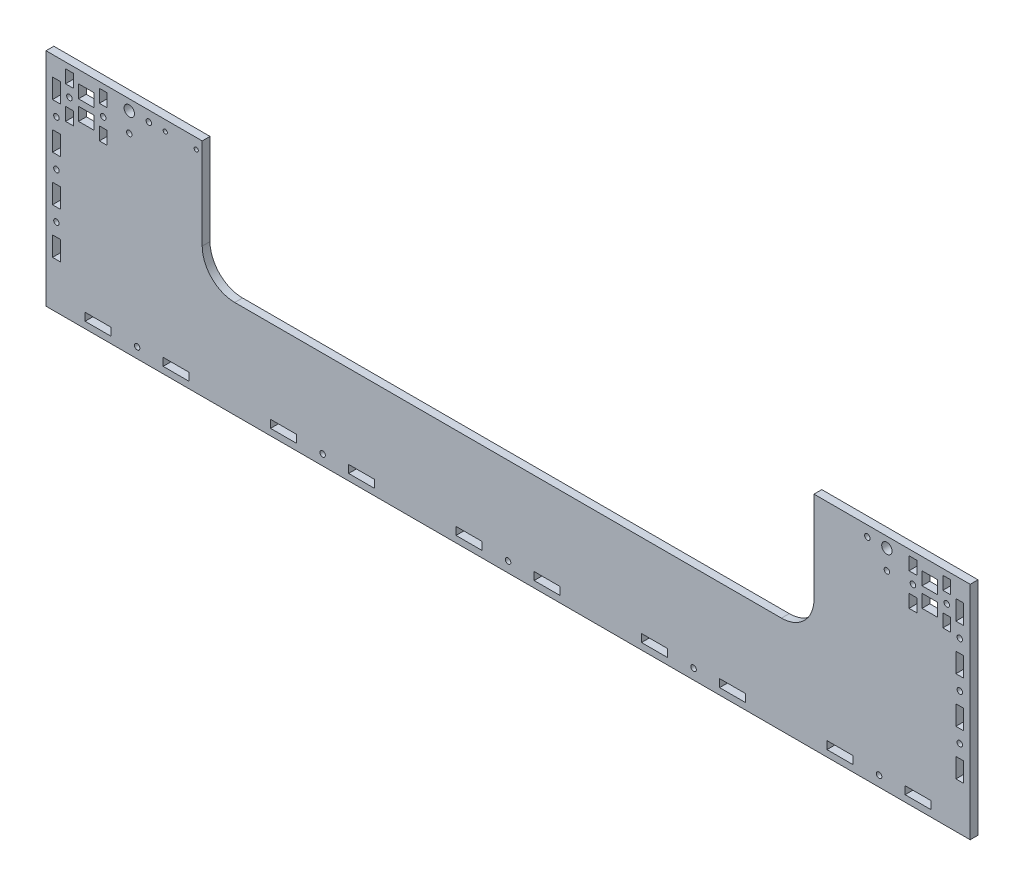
SolidWorks part; units mm, degrees
ref_plane "Спереди" through (0, 0, 0) normal (0, 0, 1) x (1, 0, 0)
ref_plane "Сверху" through (0, 0, 0) normal (0, 1, 0) x (1, 0, 0)
ref_plane "Справа" through (0, 0, 0) normal (1, 0, 0) x (0, 0, -1)
sketch "Эскиз2" plane through (0, 0, 0) normal (0, 0, 1) x (1, 0, 0)
  line L0 (0, 0) -> (0, -67.0909) construction
  line L1 (344, 50) -> (344, 35)
  line L2 (-350, 155) -> (-344, 155)
  line L3 (-350, 155) -> (-350, 140)
  line L4 (-350, 140) -> (-344, 140)
  line L5 (-344, 155) -> (-344, 140)
  line L6 (-350, 120) -> (-344, 120)
  line L7 (-350, 120) -> (-350, 105)
  line L8 (-350, 105) -> (-344, 105)
  line L9 (-344, 120) -> (-344, 105)
  line L10 (-350, 85) -> (-344, 85)
  line L11 (-350, 85) -> (-350, 70)
  line L12 (-350, 70) -> (-344, 70)
  line L13 (-344, 85) -> (-344, 70)
  line L14 (-355, 170) -> (355, 170)
  line L15 (-355, 170) -> (-355, 0)
  line L16 (-355, 0) -> (355, 0)
  line L17 (355, 170) -> (355, 0)
  line L18 (-350, 50) -> (-344, 50)
  line L19 (-350, 50) -> (-350, 35)
  line L20 (-350, 35) -> (-344, 35)
  line L21 (-344, 50) -> (-344, 35)
  line L22 (350, 35) -> (344, 35)
  line L23 (350, 50) -> (350, 35)
  line L24 (350, 50) -> (344, 50)
  line L25 (344, 85) -> (344, 70)
  line L26 (350, 70) -> (344, 70)
  line L27 (350, 85) -> (350, 70)
  line L28 (350, 85) -> (344, 85)
  line L29 (344, 120) -> (344, 105)
  line L30 (350, 105) -> (344, 105)
  line L31 (350, 120) -> (350, 105)
  line L32 (350, 120) -> (344, 120)
  line L33 (344, 155) -> (344, 140)
  line L34 (350, 140) -> (344, 140)
  line L35 (350, 155) -> (350, 140)
  line L36 (350, 155) -> (344, 155)
  circle A0 centre (-347, 130) radius 2.1
  circle A1 centre (-347, 95) radius 2.1
  circle A2 centre (-347, 60) radius 2.1
  circle A3 centre (347, 60) radius 2.1
  circle A4 centre (347, 95) radius 2.1
  circle A5 centre (347, 130) radius 2.1
  point P19 (-347, 140)
  point P20 (-347, 105)
  point P26 (0, 0)
  point P27 (-355, 85)
  point P33 (-347, 70)
  point P34 (-347, 35)
  point P57 (347, 35)
  point P58 (347, 70)
  point P59 (355, 85)
  point P60 (347, 105)
  point P61 (347, 140)
extrude "Бобышка-Вытянуть1" add sketch "Эскиз2" along normal blind 6
sketch "Эскиз3" plane through (0, 0, 6) normal (0, 0, 1) x (1, 0, 0)
  line L0 (-355, 0) -> (355, 0) construction
  line L1 (-325, 11) -> (-305, 11)
  line L2 (-325, 11) -> (-325, 5)
  line L3 (-325, 5) -> (-305, 5)
  line L4 (-305, 11) -> (-305, 5)
  line L5 (-265, 11) -> (-245, 11)
  line L6 (-265, 11) -> (-265, 5)
  line L7 (-265, 5) -> (-245, 5)
  line L8 (-245, 11) -> (-245, 5)
  line L9 (-182.5, 11) -> (-162.5, 11)
  line L10 (-182.5, 11) -> (-182.5, 5)
  line L11 (-182.5, 5) -> (-162.5, 5)
  line L12 (-162.5, 11) -> (-162.5, 5)
  line L13 (-122.5, 11) -> (-102.5, 11)
  line L14 (-122.5, 11) -> (-122.5, 5)
  line L15 (-122.5, 5) -> (-102.5, 5)
  line L16 (-102.5, 11) -> (-102.5, 5)
  line L17 (-40, 11) -> (-20, 11)
  line L18 (-40, 11) -> (-40, 5)
  line L19 (-40, 5) -> (-20, 5)
  line L20 (-20, 11) -> (-20, 5)
  line L21 (0, 0) -> (0, -153.1554) construction
  line L22 (20, 11) -> (20, 5)
  line L23 (40, 5) -> (20, 5)
  line L24 (40, 11) -> (40, 5)
  line L25 (40, 11) -> (20, 11)
  line L26 (102.5, 11) -> (102.5, 5)
  line L27 (122.5, 5) -> (102.5, 5)
  line L28 (122.5, 11) -> (122.5, 5)
  line L29 (122.5, 11) -> (102.5, 11)
  line L30 (162.5, 11) -> (162.5, 5)
  line L31 (182.5, 5) -> (162.5, 5)
  line L32 (182.5, 11) -> (182.5, 5)
  line L33 (182.5, 11) -> (162.5, 11)
  line L34 (245, 11) -> (245, 5)
  line L35 (265, 5) -> (245, 5)
  line L36 (265, 11) -> (265, 5)
  line L37 (265, 11) -> (245, 11)
  line L38 (305, 11) -> (305, 5)
  line L39 (325, 5) -> (305, 5)
  line L40 (325, 11) -> (325, 5)
  line L41 (325, 11) -> (305, 11)
  circle A0 centre (-285, 8) radius 2.1
  circle A1 centre (-142.5, 8) radius 2.1
  circle A2 centre (0, 8) radius 2.1
  circle A3 centre (142.5, 8) radius 2.1
  circle A4 centre (285, 8) radius 2.1
  point P29 (-305, 8)
  point P30 (-265, 8)
  point P31 (-20, 8)
  point P32 (-162.5, 8)
  point P34 (-122.5, 8)
  point P61 (122.5, 8)
  point P62 (162.5, 8)
  point P63 (20, 8)
  point P64 (265, 8)
  point P65 (305, 8)
extrude "Вырез-Вытянуть1" cut sketch "Эскиз3" against normal through all
sketch "Эскиз4" plane through (0, 0, 6) normal (0, 0, 1) x (1, 0, 0)
  line L0 (355, 170) -> (-355, 170) construction
  line L2 (0, 0) -> (0, -66.9248) construction
  line L3 (-355, 170) -> (-355, 0) construction
  circle A0 centre (-291, 162) radius 4
  circle A1 centre (-291, 147) radius 2.1
  circle A2 centre (-276, 162) radius 2.1
  circle A3 centre (276, 162) radius 2.1
  circle A4 centre (291, 147) radius 2.1
  circle A5 centre (291, 162) radius 4
  dimension "D1" = 8
  dimension "D4" = 4.2
  dimension "D2" = 8
  dimension "D3" = 64
  dimension "D5" = 15
  dimension "D6" = 15
extrude "Вырез-Вытянуть2" cut sketch "Эскиз4" against normal through all
sketch "Эскиз5" plane through (0, 0, 6) normal (0, 0, 1) x (1, 0, 0)
  line L0 (355, 170) -> (-355, 170) construction
  line L1 (-235, 170) -> (235, 170)
  line L2 (-235, 170) -> (-235, 100)
  line L3 (-210, 75) -> (210, 75)
  line L4 (235, 170) -> (235, 100)
  arc A0 (210, 75) -> (235, 100) centre (210, 100) ccw
  arc A1 (-235, 100) -> (-210, 75) centre (-210, 100) ccw
  dimension "D4" = 25
  dimension "D1" = 120
  dimension "D2" = 120
  dimension "D3" = 95
extrude "Вырез-Вытянуть3" cut sketch "Эскиз5" against normal through all
sketch "Эскиз6" plane through (0, 0, 6) normal (0, 0, 1) x (1, 0, 0)
  line L0 (-344, 140) -> (-344, 155) construction
  line L1 (-330, 160.5) -> (-318, 160.5)
  line L2 (-330, 160.5) -> (-330, 150.5)
  line L3 (-330, 150.5) -> (-318, 150.5)
  line L4 (-318, 160.5) -> (-318, 150.5)
  line L5 (-330, 145.5) -> (-318, 145.5)
  line L6 (-330, 145.5) -> (-330, 135.5)
  line L7 (-330, 135.5) -> (-318, 135.5)
  line L8 (-318, 145.5) -> (-318, 135.5)
  line L9 (-340, 165.5) -> (-334, 165.5)
  line L10 (-340, 165.5) -> (-340, 155.5)
  line L11 (-340, 155.5) -> (-334, 155.5)
  line L12 (-334, 165.5) -> (-334, 155.5)
  line L13 (-340, 140.5) -> (-334, 140.5)
  line L14 (-340, 140.5) -> (-340, 130.5)
  line L15 (-340, 130.5) -> (-334, 130.5)
  line L16 (-334, 140.5) -> (-334, 130.5)
  line L17 (-314, 165.5) -> (-308, 165.5)
  line L18 (-314, 165.5) -> (-314, 155.5)
  line L19 (-314, 155.5) -> (-308, 155.5)
  line L20 (-308, 165.5) -> (-308, 155.5)
  line L21 (-314, 140.5) -> (-308, 140.5)
  line L22 (-314, 140.5) -> (-314, 130.5)
  line L23 (-314, 130.5) -> (-308, 130.5)
  line L24 (-308, 140.5) -> (-308, 130.5)
  line L26 (0, 0) -> (0, -41.7086) construction
  line L27 (308, 140.5) -> (308, 130.5)
  line L28 (314, 130.5) -> (308, 130.5)
  line L29 (314, 140.5) -> (314, 130.5)
  line L30 (314, 140.5) -> (308, 140.5)
  line L31 (308, 165.5) -> (308, 155.5)
  line L32 (314, 155.5) -> (308, 155.5)
  line L33 (314, 165.5) -> (314, 155.5)
  line L34 (314, 165.5) -> (308, 165.5)
  line L35 (334, 140.5) -> (334, 130.5)
  line L36 (340, 130.5) -> (334, 130.5)
  line L37 (340, 140.5) -> (340, 130.5)
  line L38 (340, 140.5) -> (334, 140.5)
  line L39 (334, 165.5) -> (334, 155.5)
  line L40 (340, 155.5) -> (334, 155.5)
  line L41 (340, 165.5) -> (340, 155.5)
  line L42 (340, 165.5) -> (334, 165.5)
  line L43 (318, 145.5) -> (318, 135.5)
  line L44 (330, 135.5) -> (318, 135.5)
  line L45 (330, 145.5) -> (330, 135.5)
  line L46 (330, 145.5) -> (318, 145.5)
  line L47 (318, 160.5) -> (318, 150.5)
  line L48 (330, 150.5) -> (318, 150.5)
  line L49 (330, 160.5) -> (330, 150.5)
  line L50 (330, 160.5) -> (318, 160.5)
  line L51 (-235, 170) -> (-355, 170) construction
  circle A0 centre (-337, 148) radius 2.1
  circle A1 centre (-311, 148) radius 2.1
  circle A2 centre (311, 148) radius 2.1
  circle A3 centre (337, 148) radius 2.1
  point P28 (-337, 155.5)
  point P29 (-337, 140.5)
  point P32 (-311, 155.5)
  point P33 (-311, 140.5)
  point P67 (311, 140.5)
  point P68 (311, 155.5)
  point P69 (337, 140.5)
  point P70 (337, 155.5)
extrude "Вырез-Вытянуть4" cut sketch "Эскиз6" against normal through all
sketch "Эскиз7" plane through (0, 0, 6) normal (0, 0, 1) x (1, 0, 0)
  line L0 (-235, 170) -> (-235, 100) construction
  line L1 (-235, 170) -> (-355, 170) construction
  line L2 (0, 0) -> (0, -34.5906) construction
  line L3 (-355, 0) -> (355, 0) construction
  circle A0 centre (-239.6, 162) radius 1.6
  circle A1 centre (-263.4, 162) radius 1.6
  dimension "D1" = 3.2
  dimension "D2" = 23.8
  dimension "D3" = 4.6
  dimension "D4" = 8
extrude "Вырез-Вытянуть5" cut sketch "Эскиз7" against normal through all
equation "\"D6@Эскиз2\"=\"D4@Эскиз2\"/2"
equation "\"D15@Эскиз2\"=\"D13@Эскиз2\"/2"
equation "\"D9@Эскиз3\"=\"D8@Эскиз3\"/2"
equation "\"D18@Эскиз3\"=\"D17@Эскиз3\"/2"
equation "\"D20@Эскиз3\"=\"D19@Эскиз3\"/2"
equation "\"D7@Эскиз6\"=\"D3@Эскиз6\"/2"
equation "\"D6@Эскиз6\"=\"D13@Эскиз6\"/2"
equation "\"D20@Эскиз6\"=\"D19@Эскиз6\"/2"
